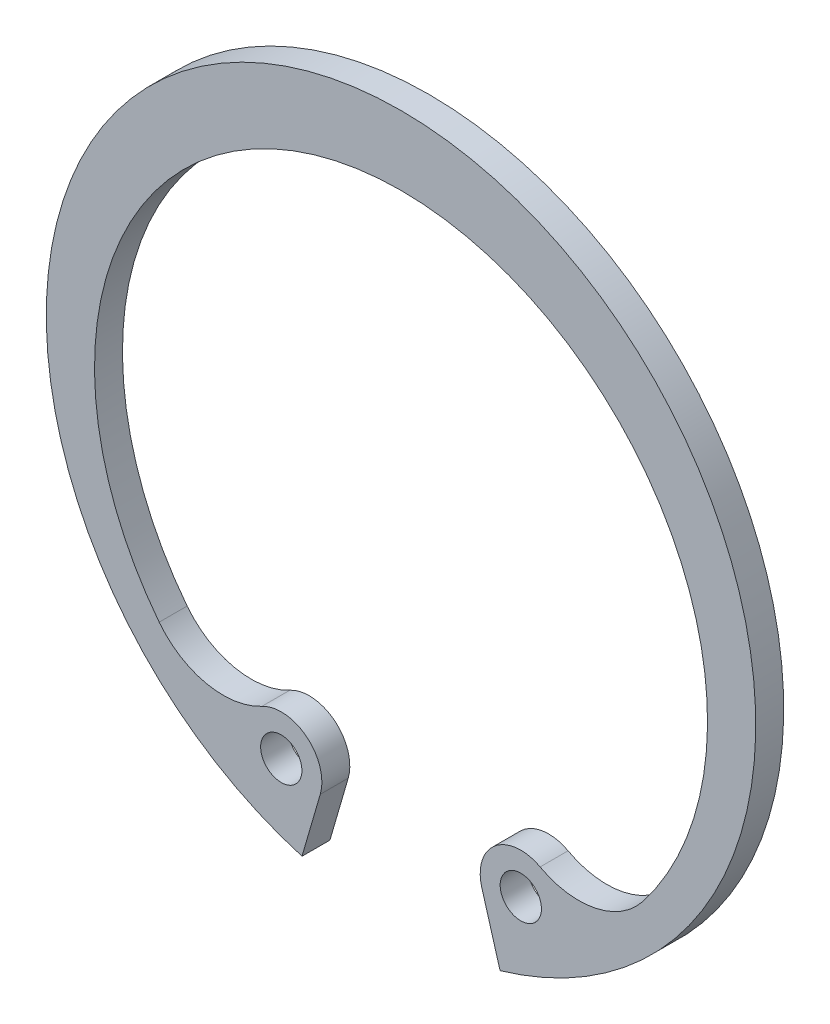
SolidWorks part; units mm, degrees
ref_plane "Plane1" through (0, 0, 0) normal (0, 0, 1) x (1, 0, 0)
ref_plane "Plane2" through (0, 0, 0) normal (0, 1, 0) x (1, 0, 0)
ref_plane "Plane3" through (0, 0, 0) normal (1, 0, 0) x (0, 0, -1)
sketch "Clipboard" plane through (0, 0, 0) normal (0, 0, 1) x (1, 0, 0)
  line L0 (0, 0) -> (2.6416, 0)
  line L1 (0, 0) -> (0, 1.3208)
  line L2 (0, 0) -> (0, -3.937)
  circle A0 centre (0, 0) radius 0.7874
  circle A1 centre (0, 0) radius 12.7
  dimension "HoleDia" = 1.5748
  dimension "BoreDia" = 25.4
  dimension "LargeSection" = 2.6416
  dimension "SmallSection" = 1.3208
  dimension "LugSection" = 3.937
sketch "BodySke" plane through (0, 0, 0) normal (0, 0, 1) x (1, 0, 0)
  line L0 (-1.5431, 0) -> (1.5431, 0) construction
  line L1 (0, 0) -> (0, 10.8966) construction
  line L2 (3.7793, -13) -> (3.0826, -10.6034)
  line L3 (-3.7793, -13) -> (-3.0826, -10.6034)
  line L4 (0, 0) -> (10.0793, -9.0383) construction
  line L5 (0, 0) -> (-10.0793, -9.0383) construction
  line L6 (-4.3506, -9.4148) -> (-4.7902, -10.927) construction
  line L7 (4.3609, -9.4501) -> (4.78, -10.8916) construction
  arc A0 (-3.0826, -10.6034) -> (-5.3085, -8.8086) centre (-4.5704, -10.1709) ccw
  arc A1 (5.3085, -8.8086) -> (3.0826, -10.6034) centre (4.5704, -10.1709) ccw
  arc A2 (9.0959, -8.1565) -> (-9.0959, -8.1565) centre (0, -0.8012) ccw construction
  arc A3 (3.7793, -13) -> (-3.7793, -13) centre (0, 0) ccw
  circle A4 centre (4.5704, -10.1709) radius 0.7874
  circle A5 centre (-4.5704, -10.1709) radius 0.7874
  arc A7 (9.2298, -7.9878) -> (-9.2298, -7.9878) centre (0, -0.8012) ccw
  arc A8 (-4.5704, -10.1709) -> (4.5704, -10.1709) centre (0, 0) ccw construction
  arc A9 (-9.2298, -7.9878) -> (-5.3085, -8.8086) centre (-6.7848, -6.084) ccw
  arc A10 (5.3085, -8.8086) -> (9.2298, -7.9878) centre (6.7848, -6.084) ccw
  dimension "GrooveDia" = 27.0764
  dimension "TipRad" = 1.5494
  dimension "HoleOffsetRad" = 11.1506
  dimension "HoleDia" = 1.5748
  dimension "FilletRad" = 3.0988
  dimension "LargeRad" = 10.8966
  dimension "SmallRad" = 12.2174
  dimension "SmallAngle" = 96.234
  dimension "GapAngle" = 32.42
extrude "Body" add sketch "BodySke" against normal blind 1.0668
sketch "ModLugSke" plane through (0, 0, 0) normal (0, 0, 1) x (1, 0, 0)
  line L0 (3.7793, -13) -> (2.8917, -9.9469)
  line L1 (-3.7793, -13) -> (-2.8917, -9.9469)
  line L2 (8.0396, -5.2486) -> (11.3362, -7.4009) construction
  line L3 (-8.0396, -5.2486) -> (-11.3362, -7.4009) construction
  line L4 (-3.7793, -13) -> (-3.0826, -10.6034) construction
  line L5 (3.0826, -10.6034) -> (3.7793, -13) construction
  line L6 (0, 0) -> (0, -12.7358) construction
  line L7 (10.1413, -6.6208) -> (11.3362, -7.4009)
  line L8 (-11.3362, -7.4009) -> (-10.1413, -6.6208)
  arc A0 (3.7793, -13) -> (11.3362, -7.4009) centre (0, 0) ccw
  arc A1 (-5.9654, -7.5231) -> (-3.3714, -8.9898) centre (0, 0) ccw
  arc A2 (3.7793, -13) -> (-3.7793, -13) centre (0, 0) ccw construction
  arc A3 (5.3085, -8.8086) -> (3.0826, -10.6034) centre (4.5704, -10.1709) ccw construction
  arc A4 (-5.9654, -7.5231) -> (-6.8331, -7.4496) centre (-6.4546, -8.1401) ccw
  arc A5 (-10.1413, -6.6208) -> (-6.8331, -7.4496) centre (-8.0396, -5.2486) ccw
  arc A6 (9.2298, -7.9878) -> (-9.2298, -7.9878) centre (0, -0.8012) ccw construction
  arc A7 (6.8331, -7.4496) -> (10.1413, -6.6208) centre (8.0396, -5.2486) ccw
  arc A8 (3.3714, -8.9898) -> (5.9654, -7.5231) centre (0, 0) ccw
  arc A9 (-11.3362, -7.4009) -> (-3.7793, -13) centre (0, 0) ccw
  circle A10 centre (-4.5704, -10.1709) radius 0.7874
  circle A11 centre (-4.5704, -10.1709) radius 0.7874 construction
  circle A12 centre (4.5704, -10.1709) radius 0.7874
  circle A13 centre (4.5704, -10.1709) radius 0.7874 construction
  arc A14 (-3.3714, -8.9898) -> (-2.8917, -9.9469) centre (-3.6478, -9.7271) cw
  arc A15 (3.3714, -8.9898) -> (2.8917, -9.9469) centre (3.6478, -9.7271) ccw
  arc A16 (5.9654, -7.5231) -> (6.8331, -7.4496) centre (6.4546, -8.1401) cw
  point P43 (2.6803, -9.2195)
  dimension "LugAng" = 76.824
extrude "ModLug" [suppressed] add sketch "ModLugSke" against normal through all
equation "' \"BoreDia@Clipboard\" = 0.25"
equation "' \"Thickness@Body\" = 0.015"
equation "' \"GrooveDia@BodySke\" = 0.268"
equation "' \"LugSection@Clipboard\" = 0.065"
equation "' \"LargeSection@Clipboard\" = 0.025"
equation "' \"SmallSection@Clipboard\" = 0.015"
equation "' \"HoleDia@Clipboard\" = 0.031"
equation "' \"BoreDia@Clipboard\" = 1.0"
equation "' \"Thickness@Body\" = 0.042"
equation "' \"GrooveDia@BodySke\" = 1.066"
equation "' \"LugSection@Clipboard\" = 0.155"
equation "' \"LargeSection@Clipboard\" = 0.104"
equation "' \"SmallSection@Clipboard\" = 0.052"
equation "' \"HoleDia@Clipboard\" = 0.062"
equation "\"TipRad@BodySke\" = (\"LugSection@Clipboard\" - (\"GrooveDia@BodySke\" / 2  -  \"BoreDia@Clipboard\" / 2 ) ) / 2"
equation "\"HoleOffsetRad@BodySke\" = (\"GrooveDia@BodySke\" / 2) - \"LugSection@Clipboard\"  + \"TipRad@BodySke\""
equation "\"LargeRad@BodySke\" =  \"GrooveDia@BodySke\" / 2 -  \"LargeSection@Clipboard\""
equation "\"SmallRad@BodySke\" =  \"GrooveDia@BodySke\" / 2 -  \"SmallSection@Clipboard\""
equation "\"HoleDia@BodySke\" =  \"HoleDia@Clipboard\""
equation "\"FilletRad@BodySke\" = \"TipRad@BodySke\" * 2"
equation "\"GapAngle@BodySke\" = 360 - 0.97 * 360 * ( \"BoreDia@Clipboard\" /  \"GrooveDia@BodySke\")"
equation "\"LugAng@ModLugSke\" = \"GapAngle@BodySke\"  + 2.5 * 360 * (\"LugSection@Clipboard\" / (\"BoreDia@Clipboard\" * 3.1416))"
